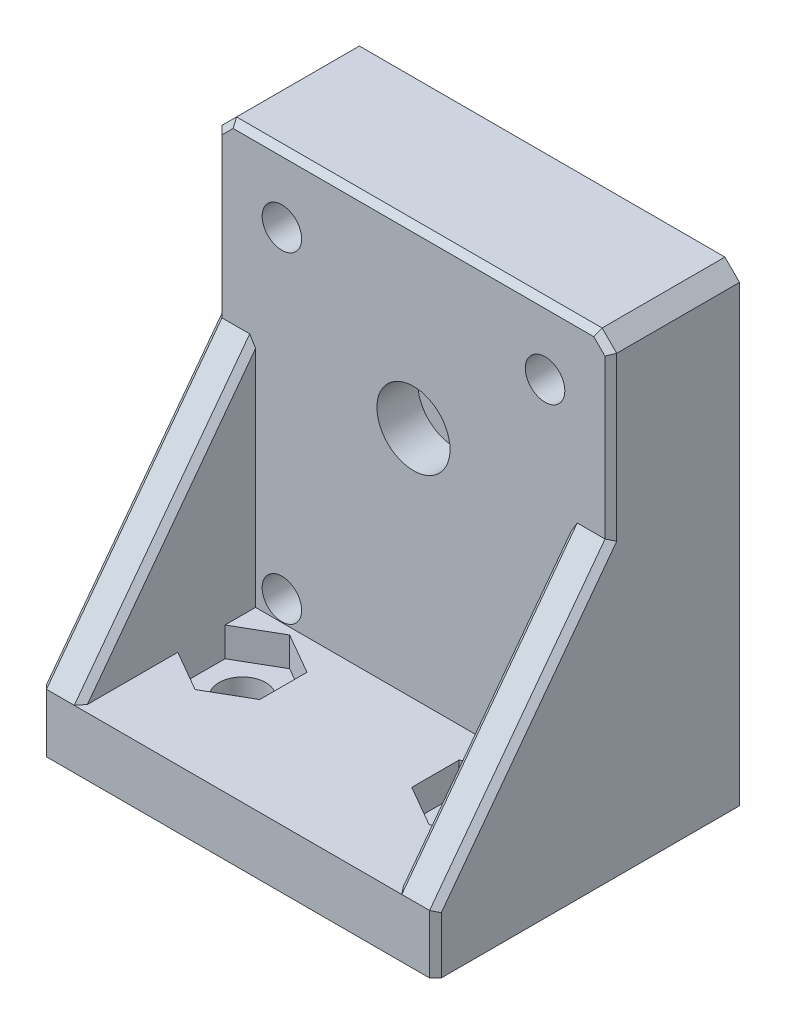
SolidWorks part; units mm, degrees
ref_plane "Přední rovina" through (0, 0, 0) normal (0, 0, 1) x (1, 0, 0)
ref_plane "Horní rovina" through (0, 0, 0) normal (0, 1, 0) x (1, 0, 0)
ref_plane "Pravá rovina" through (0, 0, 0) normal (1, 0, 0) x (0, 0, -1)
sketch "Skica1" plane through (0, 0, 0) normal (0, 0, 1) x (1, 0, 0)
  line L0 (0, 10.1887) -> (0, -21.174) construction
  line L2 (-13.5, -20) -> (13.5, -20)
  line L3 (-13.5, -20) -> (-13.5, 12)
  line L4 (-13.5, 12) -> (13.5, 12)
  line L5 (13.5, -20) -> (13.5, 12)
  line L6 (-13.5, -20) -> (13.5, 12) construction
  line L7 (-13.5, 12) -> (13.5, -20) construction
  circle A0 centre (0, 0) radius 2.5
  point P5 (0, -4)
  dimension "D2" = 5
  dimension "D1" = 20
  dimension "D3" = 27
  dimension "D4" = 32
extrude "Přidat vysunutím1" add sketch "Skica1" against normal blind 4
sketch "Skica2" plane through (0, 0, 0) normal (0, 0, -1) x (-1, 0, 0)
  line L0 (13.5, 12) -> (13.5, -20) construction
  line L1 (-13.5, -20) -> (13.5, -20)
  line L2 (-13.5, -20) -> (-13.5, -16)
  line L3 (-13.5, -16) -> (13.5, -16)
  line L4 (13.5, -20) -> (13.5, -16)
  dimension "D1" = 4
extrude "Přidat vysunutím2" add sketch "Skica2" against normal blind 12
sketch "Skica3" plane through (13.5, 0, 0) normal (1, 0, 0) x (0, 0, -1)
  line L0 (0, -16) -> (0, 0)
  line L2 (0, 0) -> (-12, -16)
  line L3 (-12, -16) -> (0, -16) construction
  line L4 (-12, -16) -> (0, -16)
  line L5 (0, -16) -> (0, 12) construction
  dimension "D1" = 16
extrude "Přidat vysunutím3" add sketch "Skica3" against normal blind 2.7
mirror "Zrcadlit1" about plane through (0, 0, 0) normal (1, 0, 0) of "Přidat vysunutím3"
sketch "Skica4" plane through (0, -20, 0) normal (0, -1, 0) x (1, 0, 0)
  line L0 (-13.5, 3.7) -> (13.5, 3.7) construction
  line L1 (-13.5, -4) -> (-13.5, 12) construction
  line L2 (13.5, -4) -> (13.5, 12) construction
  line L3 (0, 0) -> (0, 22.6668) construction
  line L5 (-10.8, 0) -> (10.8, 0) construction
  circle A0 centre (-8, 3.7) radius 1.6
  circle A1 centre (8, 3.7) radius 1.6
  dimension "D1" = 3.2
  dimension "D2" = 16
  dimension "D3" = 3.7
extrude "Odebrat vysunutím1" cut sketch "Skica4" against normal through all
sketch "Skica5" plane through (0, -16, 0) normal (0, 1, 0) x (1, 0, 0)
  line L0 (-10.8, -12) -> (-10.8, 0) construction
  line L1 (-5.2, -5.3166) -> (-5.2, -2.0834)
  line L2 (-5.2, -2.0834) -> (-8, -0.4668)
  line L3 (-8, -0.4668) -> (-10.8, -2.0834)
  line L4 (-10.8, -2.0834) -> (-10.8, -5.3166)
  line L5 (-10.8, -5.3166) -> (-8, -6.9332)
  line L6 (-8, -6.9332) -> (-5.2, -5.3166)
  line L7 (0, 0) -> (0, -13.9615) construction
  line L8 (-10.8, 0) -> (10.8, 0) construction
  line L9 (5.2, -2.0834) -> (8, -0.4668)
  line L10 (8, -6.9332) -> (5.2, -5.3166)
  line L11 (5.2, -5.3166) -> (5.2, -2.0834)
  line L12 (8, -0.4668) -> (10.8, -2.0834)
  line L13 (10.8, -2.0834) -> (10.8, -5.3166)
  line L14 (10.8, -5.3166) -> (8, -6.9332)
  circle A0 centre (-8, -3.7) radius 2.8 construction
  dimension "D1" = 5.6
extrude "Odebrat vysunutím2" cut sketch "Skica5" against normal blind 2
chamfer "Zkosení1" distance 1 angle 45 2 edges at (13.5, 12, -2) (-13.5, 12, -2)
other "Přesunout plochu1" parameters "D1"=4.8
sketch "Skica9" plane through (0, 0, -8.8) normal (0, 0, -1) x (-1, 0, 0)
  line L6 (12.5, 12) -> (-12.5, 12)
  line L7 (-12.5, 12) -> (-13.5, 11)
  line L8 (-13.5, 11) -> (-13.5, -20)
  line L9 (-13.5, -20) -> (13.5, -20)
  line L10 (13.5, -20) -> (13.5, 11)
  line L11 (13.5, 11) -> (12.5, 12)
  line L12 (12.5, 12) -> (-12.5, 12)
  line L13 (-12.5, 12) -> (-13.5, 11)
  line L14 (-13.5, 11) -> (-13.5, -20)
  line L15 (-13.5, -20) -> (13.5, -20)
  line L16 (13.5, -20) -> (13.5, 11)
  line L17 (13.5, 11) -> (12.5, 12)
  dimension "D1" = 0
extrude "Přidat vysunutím5" add sketch "Skica9" along normal blind 2 separate body
sketch "Skica10" plane through (0, 0, -10.8) normal (0, 0, 1) x (1, 0, 0)
  line L0 (0, 11.2833) -> (0, -21.892) construction
  line L1 (-22.4131, -3.6) -> (17.9451, -3.6) construction
  line L3 (0, 0) -> (7.093, 0) construction
  circle A0 centre (9, 7.4) radius 1.6
  circle A1 centre (9, -14.6) radius 1.6
  circle A2 centre (-9, -14.6) radius 1.6
  circle A3 centre (-9, 7.4) radius 1.6
  dimension "D4" = 3.2
  dimension "D1" = 18
  dimension "D2" = 22
  dimension "D3" = 3.6
extrude "Odebrat vysunutím4" cut sketch "Skica10" along normal through all
sketch "Skica12" plane through (0, 0, -10.8) normal (0, 0, -1) x (-1, 0, 0)
  circle A0 centre (-9, 7.4) radius 2.8
  circle A1 centre (-9, -14.6) radius 2.8
  circle A2 centre (9, -14.6) radius 2.8
  circle A3 centre (9, 7.4) radius 2.8
  dimension "D1" = 5.6
extrude "Odebrat vysunutím5" cut sketch "Skica12" against normal blind 0.4
sketch "Skica15" plane through (0, 0, -8.8) normal (0, 0, -1) x (-1, 0, 0)
  line L0 (0, 6.6984) -> (0, -14.5683) construction
  line L2 (-5, -11) -> (5, -11)
  line L3 (-5, -11) -> (-5, 5)
  line L4 (-5, 5) -> (5, 5)
  line L5 (5, -11) -> (5, 5)
  line L6 (-5, -11) -> (5, 5) construction
  line L7 (-5, 5) -> (5, -11) construction
  point P3 (0, -3)
  dimension "D1" = 5
  dimension "D2" = 10
  dimension "D3" = 16
extrude "Odebrat vysunutím9" cut sketch "Skica15" against normal blind 5.8
sketch "Skica17" plane through (-13.5, 0, 0) normal (-1, 0, 0) x (0, 0, 1)
  line L0 (-10.6954, 0) -> (11.9457, 0) construction
  line L1 (-8.8, 11) -> (-8.8, -20) construction
  line L2 (-5.8, 4) -> (-8.8, 4)
  line L3 (-5.8, 4) -> (-5.8, -4)
  line L4 (-5.8, -4) -> (-8.8, -4)
  line L5 (-8.8, 4) -> (-8.8, -4)
  line L6 (-5.8, 4) -> (-8.8, -4) construction
  line L7 (-5.8, -4) -> (-8.8, 4) construction
  point P3 (-7.3, 0)
  dimension "D1" = 3
  dimension "D2" = 8
extrude "Odebrat vysunutím10" cut sketch "Skica17" against normal up to surface (8.5 mm away)
sketch "Skica18" plane through (0, 0, -8.8) normal (0, 0, -1) x (-1, 0, 0)
  line L0 (5, -4) -> (13.5, -4) construction
  line L1 (5, -11) -> (8, -11)
  line L2 (5, -11) -> (5, -4)
  line L3 (5, -4) -> (8, -4)
  line L4 (8, -11) -> (8, -4)
  dimension "D1" = 3
extrude "Odebrat vysunutím11" cut sketch "Skica18" against normal up to surface (3 mm away)
chamfer "Zkosení5" distance 2 angle 45 1 edges at (-8, -4, -7.3)
chamfer "Zkosení3" distance 1.2 angle 45 4 edges at (7.4, -14.6, -10.4) (-10.6, -14.6, -10.4) (-10.6, 7.4, -10.4) (7.4, 7.4, -10.4)
chamfer "Zkosení2" distance 0.4 angle 45 11 edges at (-10.8, -8, 6) (10.8, -8, 6) (13.5, -18, 12) (-13.5, -18, 12) (13.5, -8, 6) (-13.5, -8, 6) (13, 11.5, 0) (0, 12, 0) (-13, 11.5, 0)
chamfer "Zkosení4" distance 0.4 angle 45 5 edges at (13.5, -4.5, -10.8) (13, 11.5, -10.8) (0, 12, -10.8) (-13, 11.5, -10.8) (-13.5, -4.5, -10.8)
sketch "Skica13" plane through (0, 0, 0) normal (0, 0, 1) x (1, 0, 0)
  circle A0 centre (9, 7.4) radius 1.35
  circle A1 centre (-9, 7.4) radius 1.35
  circle A2 centre (-9, -14.6) radius 1.35
  circle A3 centre (9, -14.6) radius 1.35
  circle A4 centre (9, -14.6) radius 1.6 construction
  dimension "D1" = 2.7
extrude "Odebrat vysunutím7" cut sketch "Skica13" against normal up to next
sketch "Skica19" plane through (0, 0, -3) normal (0, 0, -1) x (-1, 0, 0)
  circle A0 centre (0, 0) radius 2.5 construction
  circle A1 centre (0, 0) radius 2.5
extrude "Přidat vysunutím6" add sketch "Skica19" against normal blind 0.2
delete or keep bodies "Tělo-Odstranit1" [suppressed] type delete bodies bodies 123
delete or keep bodies "Tělo-Odstranit2" type delete bodies bodies 112
